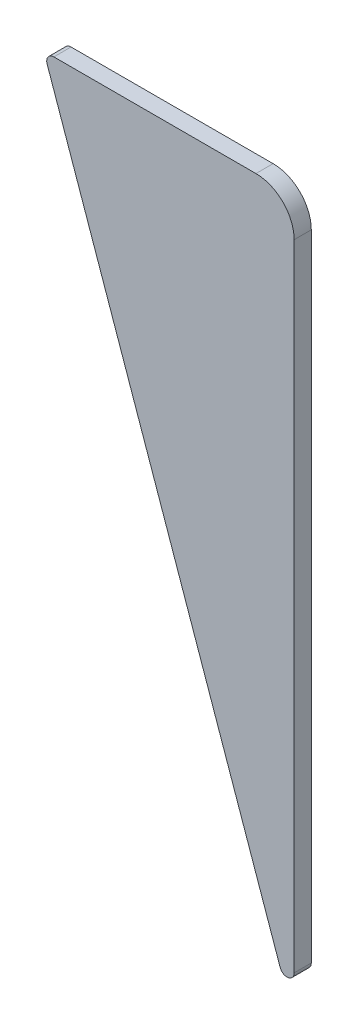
SolidWorks part; units mm, degrees
ref_plane "Front Plane" through (0, 0, 0) normal (0, 0, 1) x (1, 0, 0)
ref_plane "Top Plane" through (0, 0, 0) normal (0, 1, 0) x (1, 0, 0)
ref_plane "Right Plane" through (0, 0, 0) normal (1, 0, 0) x (0, 0, -1)
sketch "Sketch1" plane through (0, 0, 0) normal (0, 0, 1) x (1, 0, 0)
  line L0 (0, 0) -> (-44.45, 0)
  line L1 (-44.45, 0) -> (0, -127)
  line L2 (0, -127) -> (0, 0)
  dimension "D1" = 44.45
  dimension "D2" = 127
extrude "Boss-Extrude1" add sketch "Sketch1" along normal blind 3.048
fillet "Fillet1" radius 6.7818 1 edges at (0, 0, 1.524)
fillet "Fillet2" radius 1.27 2 edges at (0, -127, 1.524) (-44.45, 0, 1.524)
